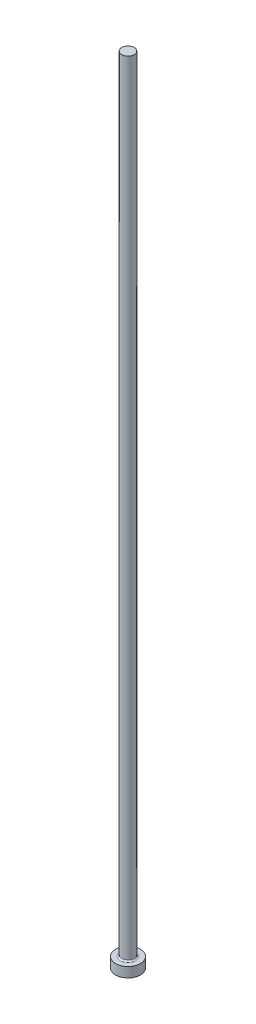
SolidWorks part; units mm, degrees
ref_plane "Plano frontal" through (0, 0, 0) normal (0, 0, 1) x (1, 0, 0)
ref_plane "Plano superior" through (0, 0, 0) normal (0, 1, 0) x (1, 0, 0)
ref_plane "Plano direito" through (0, 0, 0) normal (1, 0, 0) x (0, 0, -1)
sketch "Esboço1" plane through (0, 0, 0) normal (0, 0, 1) x (1, 0, 0)
  line L0 (0, 0) -> (2.5, 0)
  line L1 (2.5, 0) -> (2.5, 2)
  line L2 (2.5, 2) -> (1.55, 2)
  line L3 (1.25, 2.3) -> (1.25, 160)
  line L4 (1.25, 160) -> (0, 160)
  line L5 (0, 160) -> (0, 0) construction
  line L6 (0, 0) -> (0, 160)
  arc A0 (1.55, 2) -> (1.25, 2.3) centre (1.55, 2.3) cw
  dimension "D3" = 0.3
  dimension "D1" = 5
  dimension "D2" = 2.5
  dimension "D4" = 2
  dimension "D5" = 160
revolve "Revolução1" add sketch "Esboço1" angle 360 about L5
sketch "Esboço2"
  dimension "D1" = 0.2812
  dimension "D2" = 0.4375
  dimension "D3" = 0.1875
  dimension "D4" = 1.3438
wrap "Envolver1" sketch "Esboço2" wrap type deboss source sketch "Esboço2" thickness 0.1 parameters "D1"=0.1
